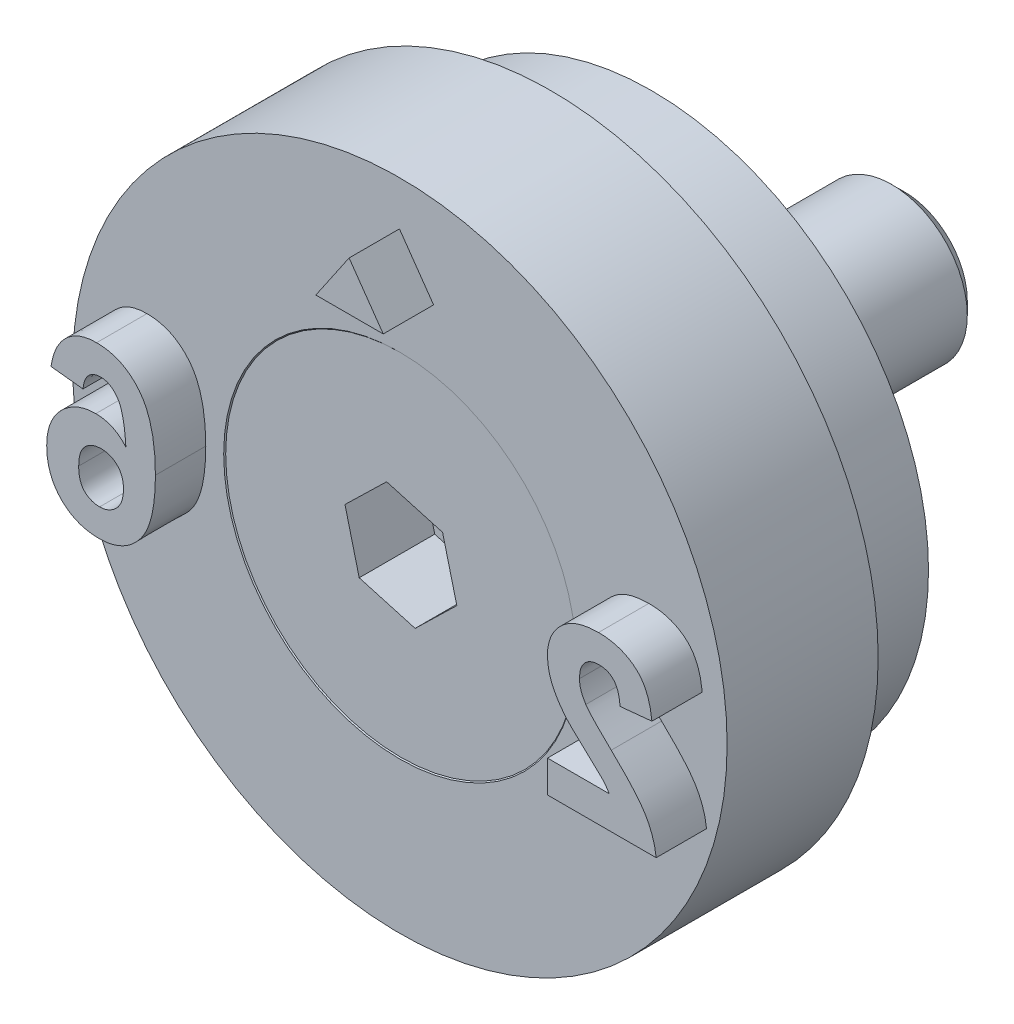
SolidWorks part; units mm, degrees
other "<M3 X .5 FHCS>-<Imported1>"
ref_plane "Front Plane" through (0, 0, 0) normal (0, 0, 1) x (1, 0, 0)
ref_plane "Top Plane" through (0, 0, 0) normal (0, 1, 0) x (1, 0, 0)
ref_plane "Right Plane" through (0, 0, 0) normal (1, 0, 0) x (0, 0, -1)
imported_body "Imported1"
other "DeleteFace1"
sketch "Sketch1" plane through (0, 0, 0) normal (0, 0, 1) x (1, 0, 0)
  line L0 (-0.0087, 5.6166) -> (-0.6694, 4.6482)
  line L1 (-0.6694, 4.6482) -> (0.6694, 4.6482)
  line L2 (0.6694, 4.6482) -> (-0.0087, 5.6166)
  text T0 "2      6" font "Arial" height 3.302
  dimension "D1" = 1.651
  dimension "D2" = 6.26
extrude "Boss-Extrude1" add sketch "Sketch1" along normal blind 1
inserted part "M3 X .5 FHCS"
move or copy body "Body-Move/Copy2" placed by mates yes
